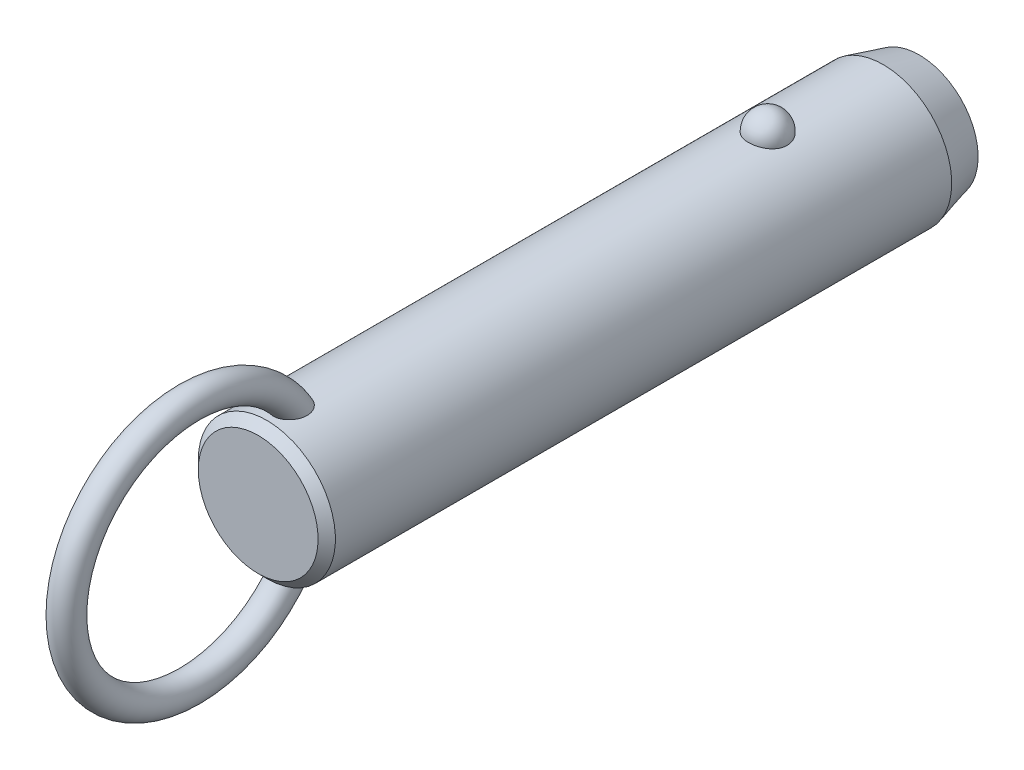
SolidWorks part; units mm, degrees
ref_plane "Front Plane" through (0, 0, 0) normal (0, 0, 1) x (1, 0, 0)
ref_plane "Top Plane" through (0, 0, 0) normal (0, 1, 0) x (1, 0, 0)
ref_plane "Right Plane" through (0, 0, 0) normal (1, 0, 0) x (0, 0, -1)
sketch "Sketch2" plane through (0, 0, 0) normal (0, 0, 1) x (1, 0, 0)
  circle A0 centre (0, 0) radius 9.5
  point P3 (0, 9.5)
  dimension "D1" = 19
extrude "Boss-Extrude1" add sketch "Sketch2" along normal blind 58.4
sketch "Sketch3" plane through (0, 0, 0) normal (0, 0, -1) x (-1, 0, 0)
  circle A0 centre (0, 0) radius 9.5
  dimension "D1" = 19
extrude "Boss-Extrude2" add sketch "Sketch3" along normal blind 23.7
chamfer "Chamfer1" distance 5 angle 15 1 edges at (-9.5, 0, -23.7)
sketch "Sketch12" plane through (0, 0, 0) normal (1, 0, 0) x (0, 0, -1)
  line L0 (-58.4, 9.5) -> (-58.4, -9.5) construction
  point P0 (-58.4, 0)
sketch "Sketch13" plane through (0, 0, 0) normal (1, 0, 0) x (0, 0, -1)
  circle A0 centre (-77.45, 0) radius 19.05
  point P2 (-58.4, 0)
  dimension "D1" = 38.1
sketch "Sketch14" plane through (0, 0, 0) normal (0, 1, 0) x (1, 0, 0)
  circle A0 centre (0, -60.4) radius 2
  point P2 (0, -58.4)
  dimension "D1" = 4
sweep "Sweep1" add profiles "Sketch14" path "Sketch13"
sketch "Sketch15" plane through (0, 0, 58.4) normal (0, 0, 1) x (1, 0, 0)
  circle A0 centre (0, 0) radius 9.5
  dimension "D1" = 19
extrude "Boss-Extrude3" add sketch "Sketch15" along normal blind 9.52
chamfer "Chamfer2" distance 1.2 angle 45 1 edges at (9.5, 0, 67.92)
sketch "Sketch18" plane through (0, 0, 0) normal (1, 0, 0) x (0, 0, -1)
  line L0 (18.7, 9.5) -> (-60.9378, 9.5) construction
  line L1 (2.7, 12.2) -> (2.7, 6.8)
  line L2 (-60.9378, -9.5) -> (18.7, -9.5) construction
  arc A0 (2.7, 12.2) -> (2.7, 6.8) centre (2.7, 9.5) ccw
  point P4 (0, 9.5)
  dimension "D1" = 21.7
revolve "Revolve1" add sketch "Sketch18" angle 360 about L1
